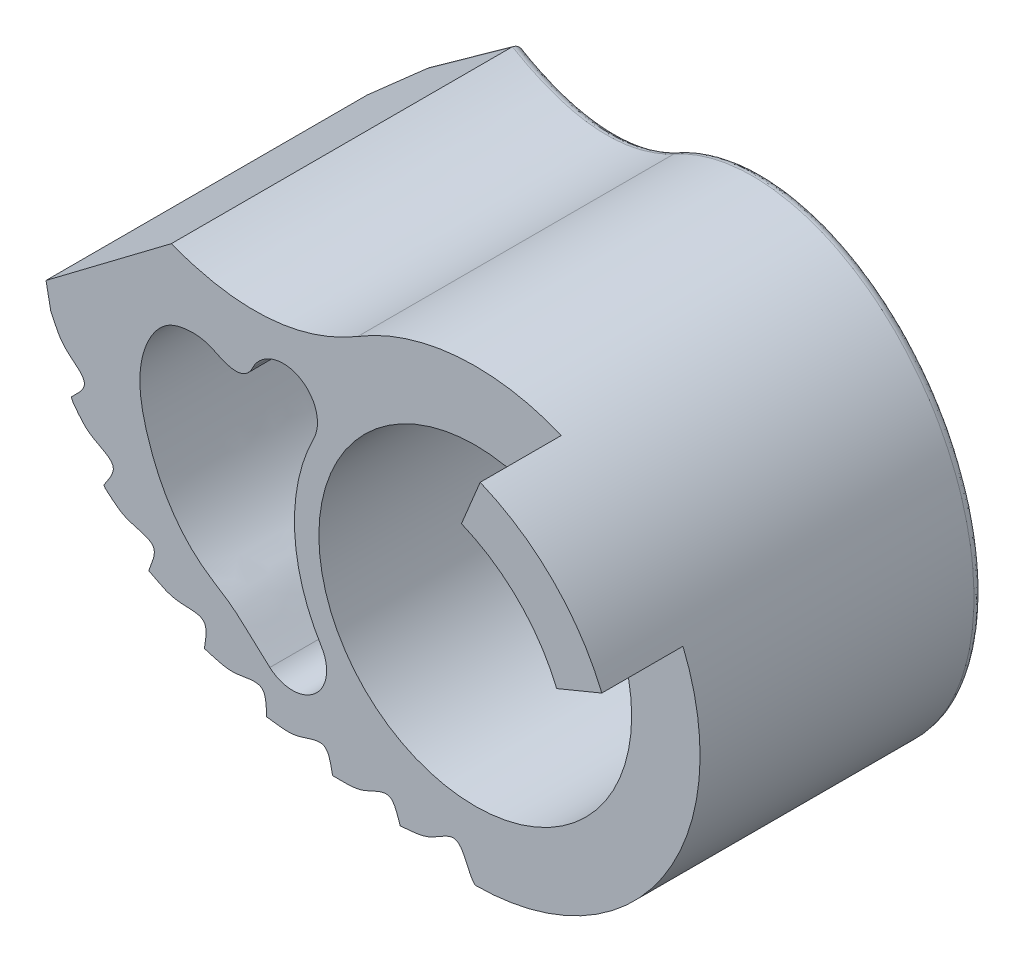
SolidWorks part; units mm, degrees
other "<Clam cleat cleat backup 2>-<Cut-Extrude9>"
ref_plane "Front Plane" through (0, 0, 0) normal (0, 0, 1) x (1, 0, 0)
ref_plane "Top Plane" through (0, 0, 0) normal (0, 1, 0) x (1, 0, 0)
ref_plane "Right Plane" through (0, 0, 0) normal (1, 0, 0) x (0, 0, -1)
mirrored part "Clam cleat cleat backup 2_Mirrored" parameters "D1.Boss-Extrude1"=18.75, "D1.Sketch1"=16, "D2.Sketch1"=23, "D1.Boss-Extrude2"=4.15, "D1.Sketch2"=11.5, "D2.Sketch2"=9, "D1.Cut-Extrude5"=14.5, "D1.Boss-Extrude4"=2, "D19.Boss-Extrude4"=10, "D1.Sketch6"=10.2, "D1.Boss-Extrude9"=2.5, "D19.Boss-Extrude9"=12, "D1.Cut-Extrude9"=11.1, "D1.Cut-Extrude6"=20, "D2.Cut-Extrude6"=20, "D1.Sketch4"=4.3, "D1.Cut-Extrude12"=30, "D1.Sketch10"=4, "D3.CrvPattern7"=3.5, "D1.CrvPattern7"=8, "D1.Sketch11"=1, "D1.Fillet2"=0.5, "D1.Sketch8"=16.3, "D1.Cut-Extrude13"=6, "D19.Cut-Extrude13"=14.5, "D1.Sketch13"=19.6, "D3.Sketch2"=45, "D4.Sketch2"=22.5, "D5.Sketch2"=22.5, "D1.Sketch12"=135, "D3.Sketch3"=1.75, "D6.Sketch3"=70, "D1.Sketch3"=45, "D7.Sketch3"=11, "D4.Sketch3"=11, "D5.Sketch3"=1.75, "D2.Sketch3"=1.3, "D8.Sketch3"=1.3, "D2.Sketch7"=12, "D3.Sketch7"=2.5, "D1.Sketch7"=12
